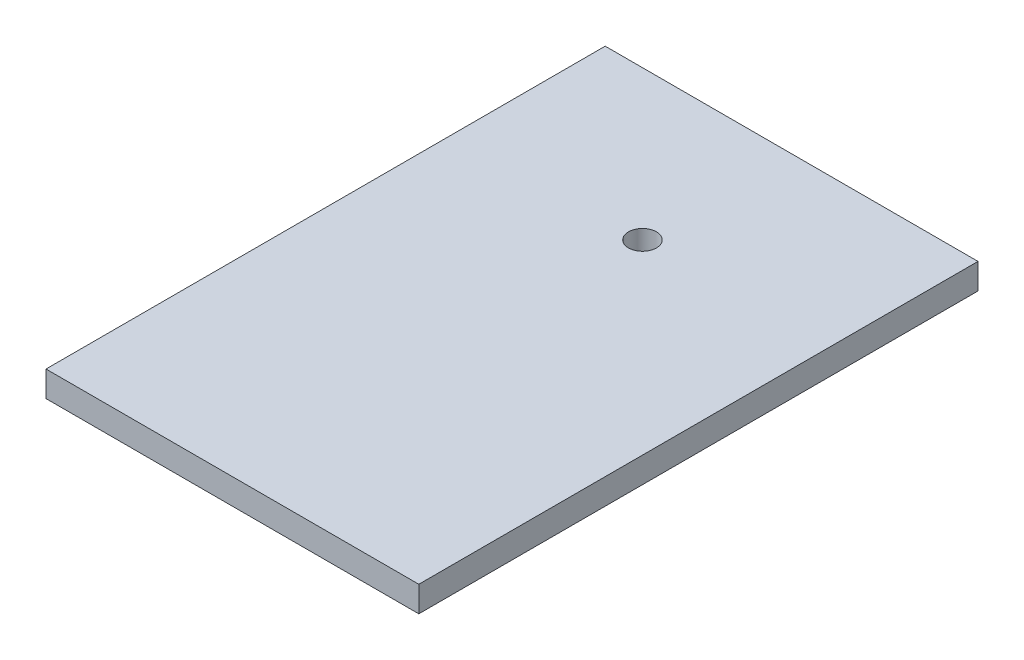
SolidWorks part; units mm, degrees
ref_plane "Front Plane" through (0, 0, 0) normal (0, 0, 1) x (1, 0, 0)
ref_plane "Top Plane" through (0, 0, 0) normal (0, 1, 0) x (1, 0, 0)
ref_plane "Right Plane" through (0, 0, 0) normal (1, 0, 0) x (0, 0, -1)
sketch "Sketch1" plane through (0, 0, 0) normal (0, 0, 1) x (1, 0, 0)
  line L1 (-127, -8.7312) -> (127, -8.7312)
  line L2 (-127, -8.7312) -> (-127, 8.7312)
  line L3 (-127, 8.7312) -> (127, 8.7312)
  line L4 (127, -8.7312) -> (127, 8.7312)
  line L5 (-127, -8.7312) -> (127, 8.7312) construction
  line L6 (-127, 8.7312) -> (127, -8.7312) construction
  point P0 (0, 0)
  dimension "D1" = 17.4625
  dimension "D2" = 254
extrude "Boss-Extrude1" add sketch "Sketch1" against normal blind 381 contours L3 L4 L1 L2
sketch "Sketch2" plane through (0, 8.7312, 0) normal (0, 1, 0) x (1, 0, 0)
  line L0 (0, 0) -> (0, 381) construction
  line L1 (-127, 0) -> (127, 0) construction
  line L2 (-127, 381) -> (127, 381) construction
  circle A0 centre (0, 279.4) radius 9.525
  dimension "D1" = 19.05
  dimension "D2" = 101.6
extrude "Cut-Extrude1" cut sketch "Sketch2" against normal through all
